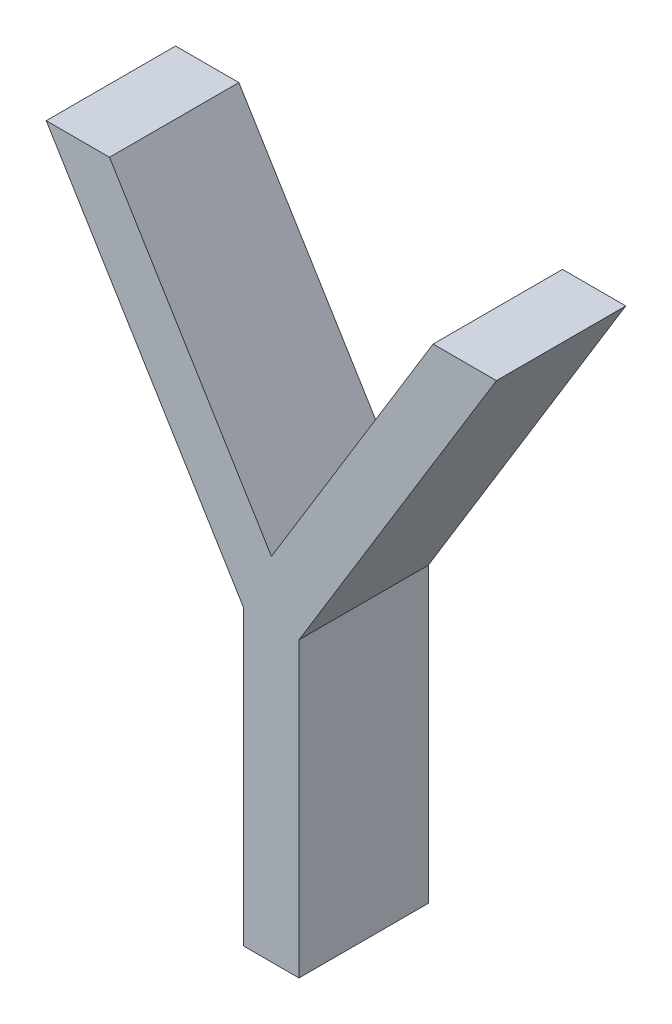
SolidWorks part; units mm, degrees
ref_plane "Face" through (0, 0, 0) normal (0, 0, 1) x (1, 0, 0)
ref_plane "Dessus" through (0, 0, 0) normal (0, 1, 0) x (1, 0, 0)
ref_plane "Droite" through (0, 0, 0) normal (1, 0, 0) x (0, 0, -1)
sketch "Esquisse1" plane through (0, 0, 0) normal (0, 0, 1) x (1, 0, 0)
  text T0 "Y" font "Century Gothic" height in points 72
extrude "Boss.-Extru.1" add sketch "Esquisse1" along normal mid plane 4
